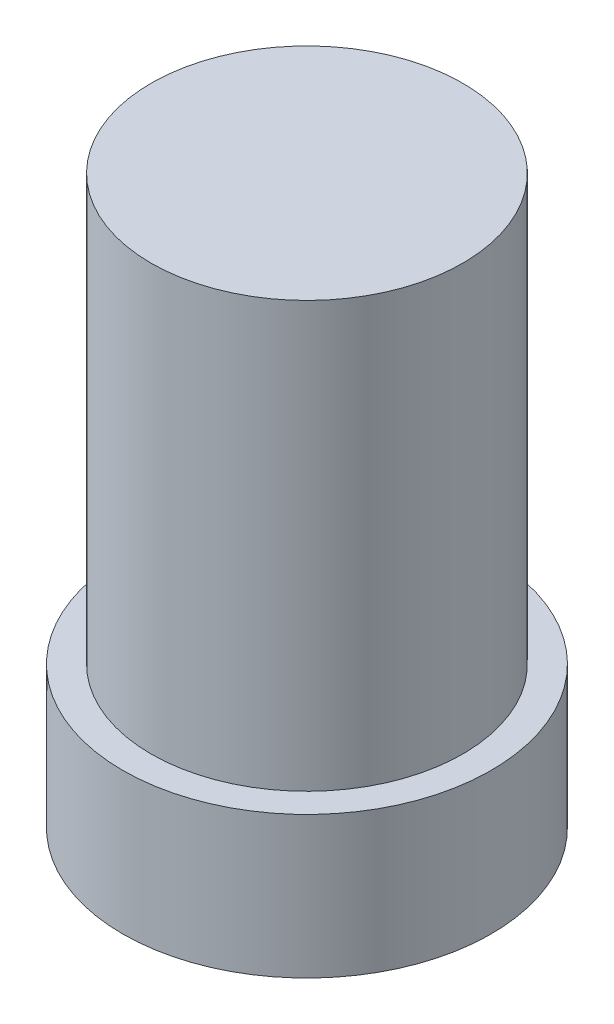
SolidWorks part; units mm, degrees
ref_plane "Front Plane" through (0, 0, 0) normal (0, 0, 1) x (1, 0, 0)
ref_plane "Top Plane" through (0, 0, 0) normal (0, 1, 0) x (1, 0, 0)
ref_plane "Right Plane" through (0, 0, 0) normal (1, 0, 0) x (0, 0, -1)
sketch "Sketch1" plane through (0, 0, 0) normal (0, 1, 0) x (1, 0, 0)
  circle A0 centre (0, 0) radius 6.5
  dimension "D1" = 13
extrude "Boss-Extrude1" add sketch "Sketch1" along normal blind 5
sketch "Sketch2" plane through (0, 5, 0) normal (0, 1, 0) x (1, 0, 0)
  circle A0 centre (0, 0) radius 5.5
  dimension "D1" = 11
extrude "Boss-Extrude2" add sketch "Sketch2" along normal blind 15
sketch "Sketch3" plane through (0, 0, 0) normal (0, -1, 0) x (1, 0, 0)
  circle A0 centre (0, 0) radius 6
  dimension "D1" = 12
extrude "Cut-Extrude1" cut sketch "Sketch3" against normal blind 4
